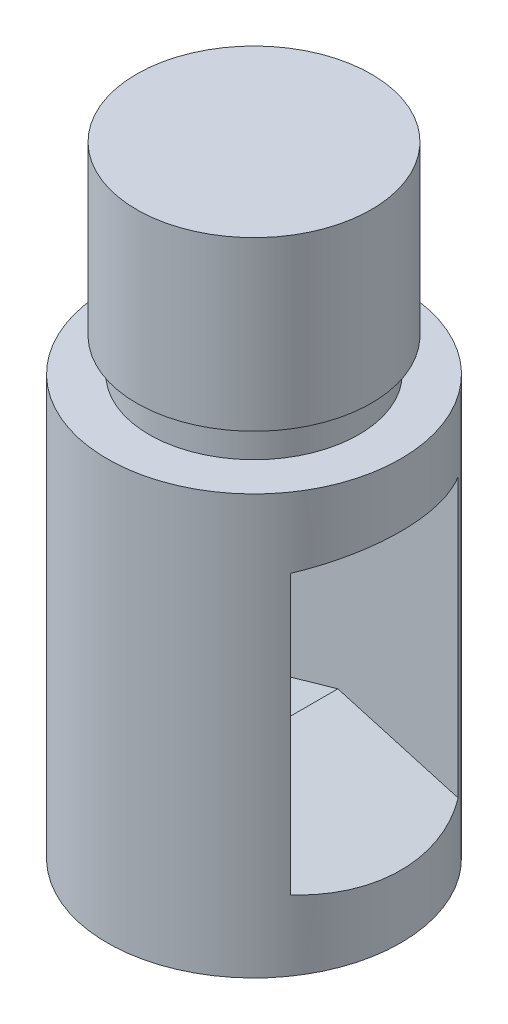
SolidWorks part; units mm, degrees
ref_plane "前视基准面" through (0, 0, 0) normal (0, 0, 1) x (1, 0, 0)
ref_plane "上视基准面" through (0, 0, 0) normal (0, 1, 0) x (1, 0, 0)
ref_plane "右视基准面" through (0, 0, 0) normal (1, 0, 0) x (0, 0, -1)
sketch "草图1" plane through (0, 0, 0) normal (0, 0, 1) x (1, 0, 0)
  line L0 (0, -91.5276) -> (0, 95.542) construction
  line L1 (0, -50) -> (-35, -50)
  line L2 (-35, -50) -> (-35, 50)
  line L3 (-35, 50) -> (-25, 50)
  line L4 (-25, 50) -> (-25, 58)
  line L5 (-25, 58) -> (-28, 58)
  line L6 (-28, 58) -> (-28, 98)
  line L7 (-28, 98) -> (0, 98)
  line L8 (0, 98) -> (0, -50)
  line L9 (0, 0) -> (-100.7606, 0) construction
  dimension "D1" = 100
  dimension "D2" = 8
  dimension "D3" = 40
  dimension "D4" = 35
  dimension "D5" = 25
  dimension "D6" = 28
revolve "旋转1" add sketch "草图1" angle 360 about L8
sketch "草图2" plane through (0, 0, 0) normal (0, 0, 1) x (1, 0, 0)
  line L0 (-66.9619, 0) -> (74.606, 0) construction
  line L1 (0, -61.0019) -> (0, 65.8894) construction
  line L2 (-35, 35) -> (0, 25)
  line L3 (-35, 50) -> (-35, -50) construction
  line L4 (0, 25) -> (35, 35)
  line L5 (35, -50) -> (35, 50) construction
  line L6 (35, 35) -> (35, -35)
  line L7 (35, -35) -> (0, -25)
  line L8 (0, -25) -> (-35, -35)
  line L9 (-35, -35) -> (-35, 35)
  dimension "D1" = 70
  dimension "D2" = 50
extrude "切除-拉伸1" cut sketch "草图2" against normal mid plane 40
